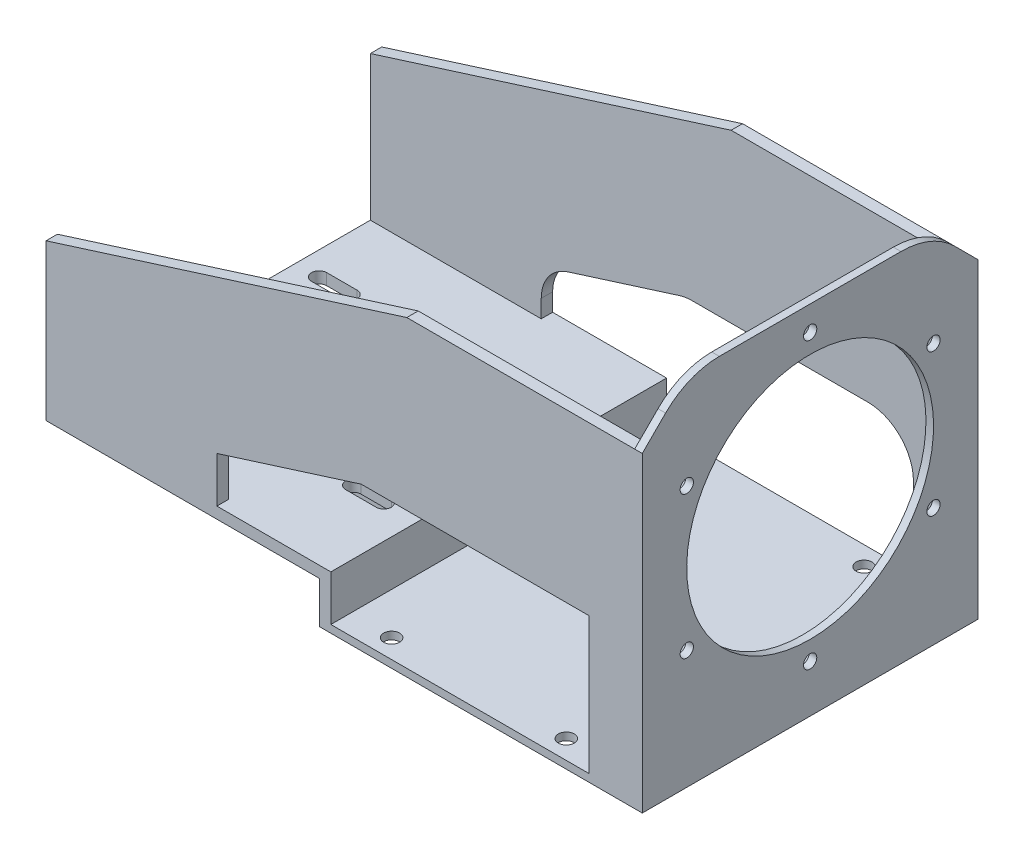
SolidWorks part; units mm, degrees
ref_plane "Front Plane" through (0, 0, 0) normal (0, 0, 1) x (1, 0, 0)
ref_plane "Top Plane" through (0, 0, 0) normal (0, 1, 0) x (1, 0, 0)
ref_plane "Right Plane" through (0, 0, 0) normal (1, 0, 0) x (0, 0, -1)
sketch "Sketch1" plane through (0, 0, 0) normal (0, 0, 1) x (1, 0, 0)
  line L0 (0, 250) -> (0, 0)
  line L1 (0, 0) -> (-785, 0)
  line L2 (-785, 0) -> (-785, 10)
  line L3 (-785, 10) -> (-10, 10)
  line L4 (-10, 10) -> (-10, 250)
  line L5 (-10, 250) -> (0, 250)
  dimension "D1" = 785
  dimension "D2" = 250
  dimension "D3" = 10
  dimension "D4" = 10
extrude "Boss-Extrude1" add sketch "Sketch1" along normal mid plane 442
sketch "Sketch2" plane through (-10, 0, 0) normal (-1, 0, 0) x (0, 0, 1)
  line L1 (0, 250) -> (0, 0) construction
  circle A1 centre (0, 250) radius 162.5
  dimension "D1" = 325
  dimension "D3" = 250
extrude "Cut-Extrude2" cut sketch "Sketch2" against normal blind 10 contours A1
sketch "Sketch4" plane through (0, 0, 0) normal (1, 0, 0) x (0, 0, -1)
  line L0 (162.5, 250) -> (221, 250)
  line L1 (-162.5, 250) -> (-221, 250)
  line L2 (-221, 250) -> (-221, 410)
  line L3 (-221, 0) -> (-221, 250) construction
  line L4 (221, 410) -> (221, 250)
  line L5 (0, 250) -> (0, 470) construction
  line L6 (-161, 470) -> (161, 470)
  line L7 (161, 470) -> (221, 410)
  line L8 (-221, 410) -> (-161, 470)
  arc A0 (162.5, 250) -> (-162.5, 250) centre (0, 250) ccw
  dimension "D1" = 160
  dimension "D2" = 220
  dimension "D3" = 60
extrude "Boss-Extrude3" add sketch "Sketch4" against normal blind 10
sketch "Sketch3" plane through (0, 0, -221) normal (0, 0, -1) x (-1, 0, 0)
  line L1 (10, 410) -> (310, 410)
  line L2 (10, 410) -> (10, 10)
  line L3 (785, 10) -> (10, 10)
  line L4 (310, 410) -> (785, 260)
  line L5 (785, 260) -> (785, 10)
  dimension "D1" = 300
  dimension "D2" = 250
extrude "Boss-Extrude4" add sketch "Sketch3" against normal blind 15 contours L4 L5 L3 L2 L1
mirror "Mirror2" about plane through (0, 0, 0) normal (0, 0, 1) of "Boss-Extrude4"
sketch "Sketch6" plane through (0, 0, -206) normal (0, 0, 1) x (1, 0, 0)
  line L0 (-785, 260) -> (-785, 10) construction
  line L1 (-410, 70) -> (-410, 10)
  line L2 (-410, 10) -> (-425, 10)
  line L3 (-410, 70) -> (-785, 70)
  line L4 (-785, 10) -> (-10, 10) construction
  line L6 (-10, 410) -> (-10, 10) construction
  line L7 (-785, 55) -> (-785, 70)
  line L9 (-785, 55) -> (-425, 55)
  line L10 (-425, 55) -> (-425, 10)
  dimension "D1" = 15
  dimension "D2" = 60
  dimension "D3" = 400
  dimension "D5" = 15
extrude "Boss-Extrude5" add sketch "Sketch6" along normal up to surface (412 mm away) contours L3 L7 L9 L10 L2 L1
sketch "Sketch14" plane through (0, 0, -221) normal (0, 0, -1) x (-1, 0, 0)
  line L0 (560, 70) -> (410, 70)
  line L1 (370, 190) -> (560, 130)
  line L2 (560, 130) -> (560, 70)
  line L3 (70, 190) -> (70, 10)
  line L4 (410, 10) -> (10, 10) construction
  line L5 (410, 70) -> (410, 10)
  line L6 (410, 70) -> (785, 70) construction
  line L7 (70, 190) -> (370, 190)
  line L8 (70, 10) -> (410, 10)
  line L9 (10, 410) -> (10, 10) construction
  line L10 (310, 410) -> (785, 260) construction
  dimension "D1" = 60
  dimension "D2" = 150
  dimension "D3" = 60
  dimension "D4" = 300
extrude "Cut-Extrude7" cut sketch "Sketch14" against normal through all contours L1 L2 L0 L5 L8 L3 L7
sketch "Sketch9" plane through (-10, 0, 0) normal (-1, 0, 0) x (0, 0, 1)
  line L0 (0, 250) -> (0, 437.5) construction
  circle A0 centre (0, 437.5) radius 8.75
  circle A1 centre (0, 250) radius 187.5 construction
  dimension "D1" = 375
  dimension "D2" = 17.5
extrude "Cut-Extrude5" cut sketch "Sketch9" against normal blind 20
sketch "Sketch7" plane through (0, 0, -221) normal (0, 0, -1) x (-1, 0, 0)
  line L0 (425, 55) -> (785, 55)
  line L1 (785, 55) -> (785, 0)
  line L2 (785, 0) -> (0, 0) construction
  line L3 (785, 0) -> (425, 0)
  line L4 (425, 0) -> (425, 55)
  line L5 (425, 55) -> (425, 10) construction
  line L7 (785, 55) -> (425, 55) construction
  line L8 (785, 260) -> (785, 0) construction
extrude "Cut-Extrude3" cut sketch "Sketch7" against normal through all
pattern_circular "CirPattern1" count 6 over 360 about axis through (0, 250, 0) along (1, 0, 0) of "Cut-Extrude5"
ref_plane "Plane1" through (0, 0, 70) normal (0, 0, 1) x (1, 0, 0)
sketch "Sketch13" plane through (0, 70, 0) normal (0, 1, 0) x (1, 0, 0)
  line L0 (-453.9, 107.5) -> (-493.9, 107.5) construction
  line L1 (-453.9, 97.5) -> (-493.9, 97.5)
  line L2 (-453.9, 117.5) -> (-493.9, 117.5)
  line L3 (-410, -221) -> (-410, 221) construction
  line L4 (-410, 0) -> (-785, 0) construction
  line L5 (-785, -206) -> (-785, 206) construction
  line L6 (-473.9, 107.5) -> (-473.9, 0) construction
  arc A0 (-453.9, 97.5) -> (-453.9, 117.5) centre (-453.9, 107.5) ccw
  arc A1 (-493.9, 117.5) -> (-493.9, 97.5) centre (-493.9, 107.5) ccw
  point P2 (-473.9, 107.5)
  dimension "D2" = 10
  dimension "D1" = 40
  dimension "D3" = 63.9
  dimension "D4" = 107.5
extrude "Cut-Extrude6" cut sketch "Sketch13" against normal through all contours L2 A1 L1 A0
pattern_linear "LPattern1" count 2 spacing 260 along (-1, 0, 0) count 2 spacing 215 along (0, 0, 1) of "Cut-Extrude6"
fillet "Fillet1" radius 100 2 edges at (-5, 470, 161) (-5, 470, -161)
fillet "Fillet4" radius 60 1 edges at (-70, 190, -213.5)
sketch "Sketch15" plane through (0, 10, 0) normal (0, 1, 0) x (1, 0, 0)
  line L0 (-125, 196) -> (-355, 196) construction
  line L1 (-70, 221) -> (-410, 221) construction
  line L2 (-240, 221) -> (-240, 196) construction
  circle A0 centre (-125, 196) radius 10.5
  circle A1 centre (-355, 196) radius 10.5
  dimension "D1" = 25
  dimension "D3" = 21
  dimension "D2" = 230
extrude "Cut-Extrude8" cut sketch "Sketch15" against normal through all
mirror "Mirror5" about plane through (0, 0, 0) normal (0, 0, 1) of "Cut-Extrude8"
fillet "Fillet6" radius 50 2 edges at (-370, 190, -213.5) (-560, 130, -213.5)
sketch "Sketch16" plane through (0, 0, 70) normal (0, 0, 1) x (1, 0, 0)
  line L0 (-425, 0) -> (0, 0) construction
  line L1 (-425, 55) -> (-785, 55)
  line L2 (-425, 55) -> (-425, 0)
  line L3 (-425, 0) -> (-785, 0)
  line L4 (-785, 55) -> (-785, 0)
  line L5 (-785, 260) -> (-785, 55) construction
extrude "Boss-Extrude6" add sketch "Sketch16" against normal blind 15
mirror "Mirror6" about plane through (0, 0, 0) normal (0, 0, 1) of "Boss-Extrude6"
